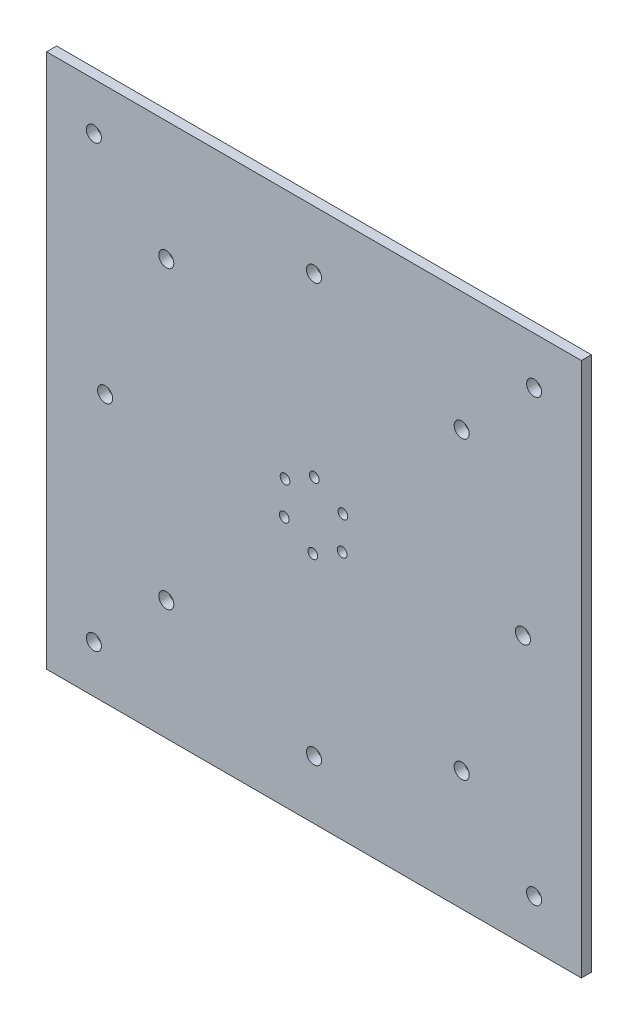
SolidWorks part; units mm, degrees
ref_plane "Plan de face" through (0, 0, 0) normal (0, 0, 1) x (1, 0, 0)
ref_plane "Plan de dessus" through (0, 0, 0) normal (0, 1, 0) x (1, 0, 0)
ref_plane "Plan de droite" through (0, 0, 0) normal (1, 0, 0) x (0, 0, -1)
sketch "Esquisse1" plane through (0, 0, 0) normal (0, 0, 1) x (1, 0, 0)
  line L1 (80, -80) -> (-80, -80)
  line L2 (80, -80) -> (80, 80)
  line L3 (80, 80) -> (-80, 80)
  line L4 (-80, -80) -> (-80, 80)
  line L5 (80, -80) -> (-80, 80) construction
  line L6 (80, 80) -> (-80, -80) construction
  circle A0 centre (0, 0) radius 80
  dimension "D1" = 160
extrude "Boss.-Extru.1" add sketch "Esquisse1" along normal blind 3 contours A0 | A0 L2 L3 | A0 L3 L4 | A0 L4 L1 | A0 L1 L2
hole_wizard "Dégagement M2.51" positions "Esquisse2" profile "Esquisse3" hole size "M2.5" standard "ISO"
sketch "Esquisse2" plane through (0, 0, 0) normal (0, 0, -1) x (-1, 0, 0)
  point P0 (-0.1138, 9.7975)
  point P8 (8.6603, 5)
  point P9 (8.8925, -4.9973)
  point P10 (0.3507, -10.1971)
  point P11 (-8.4233, -5.3996)
  point P12 (-8.6556, 4.5978)
  dimension "D1" = 6
sketch "Esquisse3" plane through (0.1138, 9.7975, 0) normal (1, 0, 0) x (0, 1, 0)
  line L0 (0, 0) -> (0, 3)
  line L1 (0, 3) -> (1.45, 3)
  line L2 (1.45, 3) -> (1.45, 0)
  line L5 (1.45, 0) -> (0, 0)
  line L11 (0, -6.35) -> (0, 107.95) construction
  dimension "Diamètre du perçage jusqu'au prochain" = 2.9
  dimension "Profondeur du perçage jusqu'au prochain" = 3
ref_plane "Plan1" through (0, 0, -35) normal (0, 0, -1) x (-1, 0, 0)
hole_wizard "M4 Clearance Hole1" positions "Sketch1" profile "Sketch2" hole size "M4" standard "ISO"
sketch "Sketch1" plane through (0, 0, 0) normal (0, 0, -1) x (-1, 0, 0)
  line L0 (0, 0) -> (-80, 80) construction
  line L1 (-80, -80) -> (-80, 80) construction
  point P0 (0, 62.5)
  point P16 (44.1942, 44.1942)
  point P17 (62.5, 0)
  point P18 (44.1942, -44.1942)
  point P19 (0, -62.5)
  point P20 (-44.1942, -44.1942)
  point P21 (-62.5, 0)
  point P22 (-44.1942, 44.1942)
  point P37 (-65.8579, 65.8579)
  point P43 (65.8579, 65.8579)
  point P44 (65.8579, -65.8579)
  point P45 (-65.8579, -65.8579)
  dimension "D1" = 62.5
  dimension "D3" = 20
  dimension "D2" = 8
  dimension "D4" = 4
sketch "Sketch2" plane through (0, 62.5, 0) normal (1, 0, 0) x (0, 1, 0)
  line L0 (0, 0) -> (0, 3)
  line L1 (0, 3) -> (2.25, 3)
  line L2 (2.25, 3) -> (2.25, 0)
  line L5 (2.25, 0) -> (0, 0)
  line L11 (0, -6.35) -> (0, 107.95) construction
  dimension "Thru Hole Dia." = 4.5
  dimension "Thru Hole Depth" = 3
